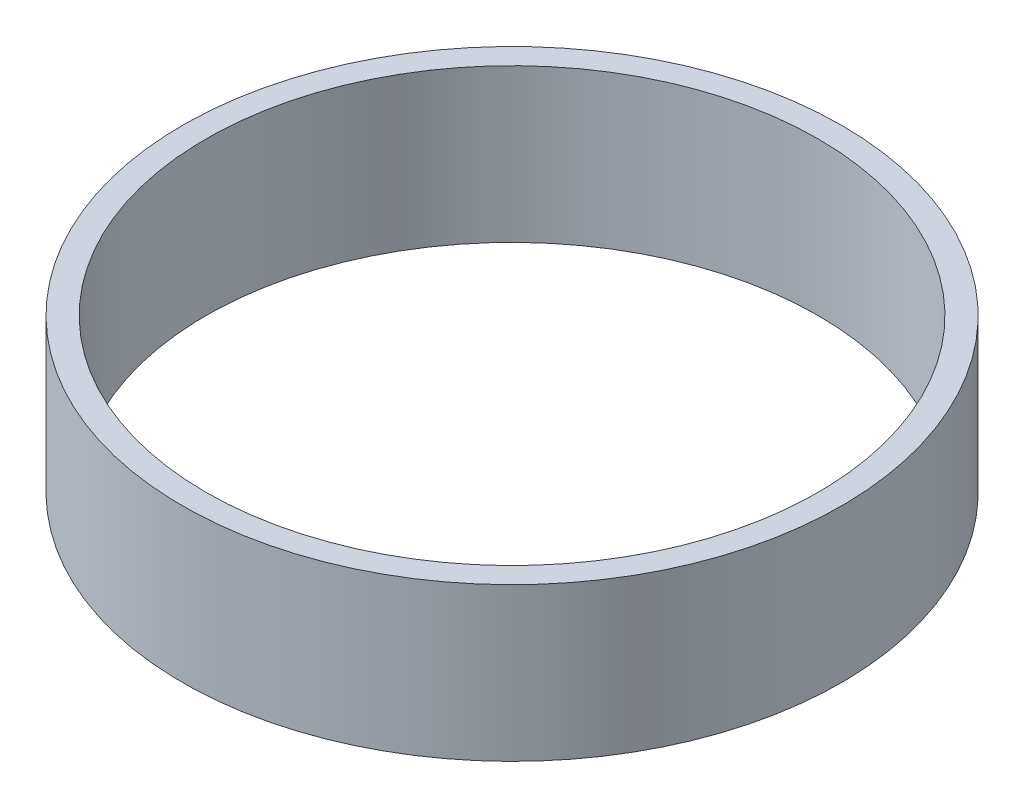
SolidWorks part; units mm, degrees
ref_plane "Front Plane" through (0, 0, 0) normal (0, 0, 1) x (1, 0, 0)
ref_plane "Top Plane" through (0, 0, 0) normal (0, 1, 0) x (1, 0, 0)
ref_plane "Right Plane" through (0, 0, 0) normal (1, 0, 0) x (0, 0, -1)
sketch "Sketch1" plane through (0, 0, 0) normal (0, 1, 0) x (1, 0, 0)
  circle A0 centre (0, 0) radius 20.5105
  circle A1 centre (0, 0) radius 19.05
  dimension "D1" = 38.1
  dimension "D2" = 41.021
extrude "Boss-Extrude1" add sketch "Sketch1" along normal blind 9.525
